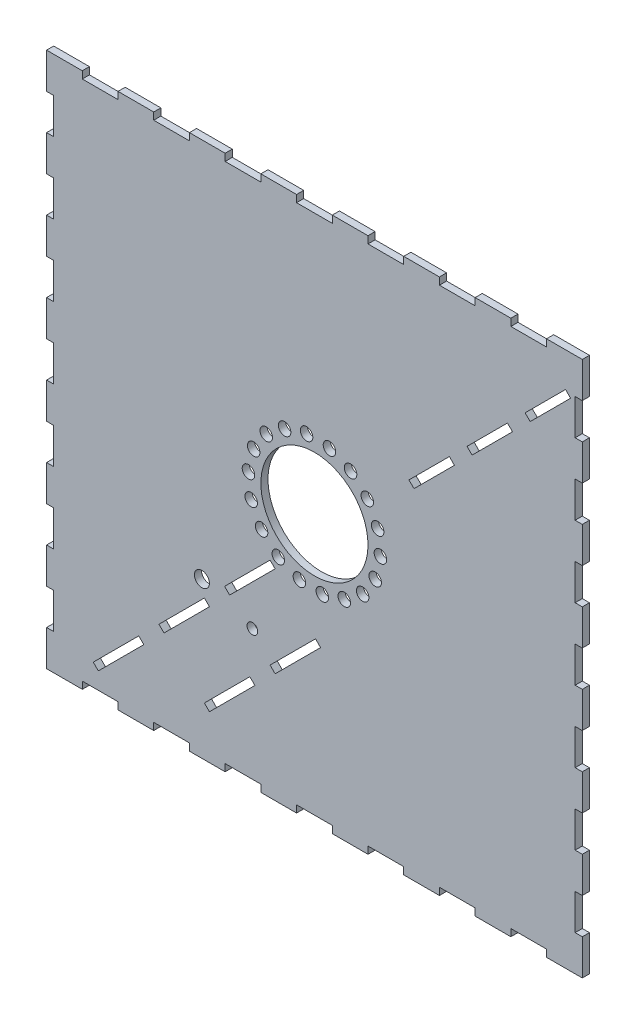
SolidWorks part; units mm, degrees
ref_plane "Front Plane" through (0, 0, 0) normal (0, 0, 1) x (1, 0, 0)
ref_plane "Top Plane" through (0, 0, 0) normal (0, 1, 0) x (1, 0, 0)
ref_plane "Right Plane" through (0, 0, 0) normal (1, 0, 0) x (0, 0, -1)
sketch "Sketch1" plane through (0, 0, 0) normal (0, 0, 1) x (1, 0, 0)
  line L1 (75, -75) -> (-75, -75)
  line L2 (75, -75) -> (75, 75)
  line L3 (75, 75) -> (-75, 75)
  line L4 (-75, -75) -> (-75, 75)
extrude "Boss-Extrude1" add sketch "Sketch1" against normal blind 2
other "Cavity1"
other "sideTop<2>@body1"
other "sideTop<1>@body1"
other "sideTop<3>@body1"
other "sideTop<4>@body1"
sketch "Sketch2" plane through (0, 0, 0) normal (0, 0, 1) x (1, 0, 0)
  line L116 (-75, -75) -> (-65, -75)
  line L117 (-65, -75) -> (-65, -73)
  line L118 (-65, -75) -> (-65, -73)
  line L119 (-65, -73) -> (-55, -73)
  line L120 (-65, -73) -> (-55, -73)
  line L121 (-55, -73) -> (-55, -75)
  line L122 (-55, -73) -> (-55, -75)
  line L123 (-55, -75) -> (-45, -75)
  line L124 (-55, -75) -> (-45, -75)
  line L125 (-45, -75) -> (-45, -73)
  line L126 (-45, -75) -> (-45, -73)
  line L127 (-45, -73) -> (-35, -73)
  line L128 (-45, -73) -> (-35, -73)
  line L129 (-35, -73) -> (-35, -75)
  line L130 (-35, -73) -> (-35, -75)
  line L131 (-35, -75) -> (-25, -75)
  line L132 (-35, -75) -> (-25, -75)
  line L133 (-25, -75) -> (-25, -73)
  line L134 (-25, -75) -> (-25, -73)
  line L135 (-25, -73) -> (-15, -73)
  line L136 (-25, -73) -> (-15, -73)
  line L137 (-15, -73) -> (-15, -75)
  line L138 (-15, -73) -> (-15, -75)
  line L139 (-15, -75) -> (-5, -75)
  line L140 (-15, -75) -> (-5, -75)
  line L141 (-5, -75) -> (-5, -73)
  line L142 (-5, -75) -> (-5, -73)
  line L143 (-5, -73) -> (5, -73)
  line L144 (-5, -73) -> (5, -73)
  line L145 (75, -75) -> (75, -65)
  line L146 (5, -73) -> (5, -75)
  line L147 (5, -73) -> (5, -75)
  line L148 (5, -75) -> (15, -75)
  line L149 (5, -75) -> (15, -75)
  line L150 (15, -75) -> (15, -73)
  line L151 (15, -75) -> (15, -73)
  line L152 (15, -73) -> (25, -73)
  line L153 (15, -73) -> (25, -73)
  line L154 (25, -73) -> (25, -75)
  line L155 (25, -73) -> (25, -75)
  line L156 (25, -75) -> (35, -75)
  line L157 (25, -75) -> (35, -75)
  line L158 (35, -75) -> (35, -73)
  line L159 (35, -75) -> (35, -73)
  line L160 (35, -73) -> (45, -73)
  line L161 (35, -73) -> (45, -73)
  line L162 (45, -73) -> (45, -75)
  line L163 (45, -73) -> (45, -75)
  line L164 (45, -75) -> (55, -75)
  line L165 (45, -75) -> (55, -75)
  line L166 (55, -75) -> (55, -73)
  line L167 (55, -75) -> (55, -73)
  line L168 (55, -73) -> (65, -73)
  line L169 (55, -73) -> (65, -73)
  line L170 (65, -73) -> (65, -75)
  line L171 (65, -73) -> (65, -75)
  line L172 (65, -75) -> (75, -75)
  line L173 (65, -75) -> (75, -75)
  line L174 (75, 75) -> (65, 75)
  line L175 (75, -65) -> (73, -65)
  line L176 (75, -65) -> (73, -65)
  line L177 (73, -65) -> (73, -55)
  line L178 (73, -65) -> (73, -55)
  line L179 (73, -55) -> (75, -55)
  line L180 (73, -55) -> (75, -55)
  line L181 (75, -55) -> (75, -45)
  line L182 (75, -55) -> (75, -45)
  line L183 (75, -45) -> (73, -45)
  line L184 (75, -45) -> (73, -45)
  line L185 (73, -45) -> (73, -35)
  line L186 (73, -45) -> (73, -35)
  line L187 (73, -35) -> (75, -35)
  line L188 (73, -35) -> (75, -35)
  line L189 (75, -35) -> (75, -25)
  line L190 (75, -35) -> (75, -25)
  line L191 (75, -25) -> (73, -25)
  line L192 (75, -25) -> (73, -25)
  line L193 (73, -25) -> (73, -15)
  line L194 (73, -25) -> (73, -15)
  line L195 (73, -15) -> (75, -15)
  line L196 (73, -15) -> (75, -15)
  line L197 (75, -15) -> (75, -5)
  line L198 (75, -15) -> (75, -5)
  line L199 (75, -5) -> (73, -5)
  line L200 (75, -5) -> (73, -5)
  line L201 (73, -5) -> (73, 5)
  line L202 (73, -5) -> (73, 5)
  line L203 (-75, 75) -> (-75, 65)
  line L204 (73, 5) -> (75, 5)
  line L205 (73, 5) -> (75, 5)
  line L206 (75, 5) -> (75, 15)
  line L207 (75, 5) -> (75, 15)
  line L208 (75, 15) -> (73, 15)
  line L209 (75, 15) -> (73, 15)
  line L210 (73, 15) -> (73, 25)
  line L211 (73, 15) -> (73, 25)
  line L212 (73, 25) -> (75, 25)
  line L213 (73, 25) -> (75, 25)
  line L214 (75, 25) -> (75, 35)
  line L215 (75, 25) -> (75, 35)
  line L216 (75, 35) -> (73, 35)
  line L217 (75, 35) -> (73, 35)
  line L218 (73, 35) -> (73, 45)
  line L219 (73, 35) -> (73, 45)
  line L220 (73, 45) -> (75, 45)
  line L221 (73, 45) -> (75, 45)
  line L222 (75, 45) -> (75, 55)
  line L223 (75, 45) -> (75, 55)
  line L224 (75, 55) -> (73, 55)
  line L225 (75, 55) -> (73, 55)
  line L226 (73, 55) -> (73, 65)
  line L227 (73, 55) -> (73, 65)
  line L228 (73, 65) -> (75, 65)
  line L229 (73, 65) -> (75, 65)
  line L230 (75, 65) -> (75, 75)
  line L231 (75, 65) -> (75, 75)
  line L232 (-75, -75) -> (-65, -75)
  line L261 (75, -75) -> (75, -65)
  line L290 (75, 75) -> (65, 75)
  line L319 (-75, 75) -> (-75, 65)
  line L348 (65, 75) -> (65, 73)
  line L349 (65, 75) -> (65, 73)
  line L350 (65, 73) -> (55, 73)
  line L351 (65, 73) -> (55, 73)
  line L352 (55, 73) -> (55, 75)
  line L353 (55, 73) -> (55, 75)
  line L354 (55, 75) -> (45, 75)
  line L355 (55, 75) -> (45, 75)
  line L356 (45, 75) -> (45, 73)
  line L357 (45, 75) -> (45, 73)
  line L358 (45, 73) -> (35, 73)
  line L359 (45, 73) -> (35, 73)
  line L360 (35, 73) -> (35, 75)
  line L361 (35, 73) -> (35, 75)
  line L362 (35, 75) -> (25, 75)
  line L363 (35, 75) -> (25, 75)
  line L364 (25, 75) -> (25, 73)
  line L365 (25, 75) -> (25, 73)
  line L366 (25, 73) -> (15, 73)
  line L367 (25, 73) -> (15, 73)
  line L368 (15, 73) -> (15, 75)
  line L369 (15, 73) -> (15, 75)
  line L370 (15, 75) -> (5, 75)
  line L371 (15, 75) -> (5, 75)
  line L372 (5, 75) -> (5, 73)
  line L373 (5, 75) -> (5, 73)
  line L374 (5, 73) -> (-5, 73)
  line L375 (5, 73) -> (-5, 73)
  line L376 (-5, 73) -> (-5, 75)
  line L377 (-5, 73) -> (-5, 75)
  line L378 (-5, 75) -> (-15, 75)
  line L379 (-5, 75) -> (-15, 75)
  line L380 (-15, 75) -> (-15, 73)
  line L381 (-15, 75) -> (-15, 73)
  line L382 (-15, 73) -> (-25, 73)
  line L383 (-15, 73) -> (-25, 73)
  line L384 (-25, 73) -> (-25, 75)
  line L385 (-25, 73) -> (-25, 75)
  line L386 (-25, 75) -> (-35, 75)
  line L387 (-25, 75) -> (-35, 75)
  line L388 (-35, 75) -> (-35, 73)
  line L389 (-35, 75) -> (-35, 73)
  line L390 (-35, 73) -> (-45, 73)
  line L391 (-35, 73) -> (-45, 73)
  line L392 (-45, 73) -> (-45, 75)
  line L393 (-45, 73) -> (-45, 75)
  line L394 (-45, 75) -> (-55, 75)
  line L395 (-45, 75) -> (-55, 75)
  line L396 (-55, 75) -> (-55, 73)
  line L397 (-55, 75) -> (-55, 73)
  line L398 (-55, 73) -> (-65, 73)
  line L399 (-55, 73) -> (-65, 73)
  line L400 (-65, 73) -> (-65, 75)
  line L401 (-65, 73) -> (-65, 75)
  line L402 (-65, 75) -> (-75, 75)
  line L403 (-65, 75) -> (-75, 75)
  line L404 (-75, 65) -> (-73, 65)
  line L405 (-75, 65) -> (-73, 65)
  line L406 (-73, 65) -> (-73, 55)
  line L407 (-73, 65) -> (-73, 55)
  line L408 (-73, 55) -> (-75, 55)
  line L409 (-73, 55) -> (-75, 55)
  line L410 (-75, 55) -> (-75, 45)
  line L411 (-75, 55) -> (-75, 45)
  line L412 (-75, 45) -> (-73, 45)
  line L413 (-75, 45) -> (-73, 45)
  line L414 (-73, 45) -> (-73, 35)
  line L415 (-73, 45) -> (-73, 35)
  line L416 (-73, 35) -> (-75, 35)
  line L417 (-73, 35) -> (-75, 35)
  line L418 (-75, 35) -> (-75, 25)
  line L419 (-75, 35) -> (-75, 25)
  line L420 (-75, 25) -> (-73, 25)
  line L421 (-75, 25) -> (-73, 25)
  line L422 (-73, 25) -> (-73, 15)
  line L423 (-73, 25) -> (-73, 15)
  line L424 (-73, 15) -> (-75, 15)
  line L425 (-73, 15) -> (-75, 15)
  line L426 (-75, 15) -> (-75, 5)
  line L427 (-75, 15) -> (-75, 5)
  line L428 (-75, 5) -> (-73, 5)
  line L429 (-75, 5) -> (-73, 5)
  line L430 (-73, 5) -> (-73, -5)
  line L431 (-73, 5) -> (-73, -5)
  line L432 (-73, -5) -> (-75, -5)
  line L433 (-73, -5) -> (-75, -5)
  line L434 (-75, -5) -> (-75, -15)
  line L435 (-75, -5) -> (-75, -15)
  line L436 (-75, -15) -> (-73, -15)
  line L437 (-75, -15) -> (-73, -15)
  line L438 (-73, -15) -> (-73, -25)
  line L439 (-73, -15) -> (-73, -25)
  line L440 (-73, -25) -> (-75, -25)
  line L441 (-73, -25) -> (-75, -25)
  line L442 (-75, -25) -> (-75, -35)
  line L443 (-75, -25) -> (-75, -35)
  line L444 (-75, -35) -> (-73, -35)
  line L445 (-75, -35) -> (-73, -35)
  line L446 (-73, -35) -> (-73, -45)
  line L447 (-73, -35) -> (-73, -45)
  line L448 (-73, -45) -> (-75, -45)
  line L449 (-73, -45) -> (-75, -45)
  line L450 (-75, -45) -> (-75, -55)
  line L451 (-75, -45) -> (-75, -55)
  line L452 (-75, -55) -> (-73, -55)
  line L453 (-75, -55) -> (-73, -55)
  line L454 (-73, -55) -> (-73, -65)
  line L455 (-73, -55) -> (-73, -65)
  line L456 (-73, -65) -> (-75, -65)
  line L457 (-73, -65) -> (-75, -65)
  line L458 (-75, -65) -> (-75, -75)
  line L459 (-75, -65) -> (-75, -75)
  circle A0 centre (0, 0) radius 15 construction
  circle A1 centre (0, 0) radius 15
  dimension "D1" = 0
extrude "Cut-Extrude2" cut sketch "Sketch2" against normal blind 2 contours A1
sketch "Sketch4" plane through (0, 0, 0) normal (0, 0, 1) x (1, 0, 0)
  circle A0 centre (10.1185, 15.4876) radius 1.75 construction
  circle A1 centre (10.1185, 15.4876) radius 1.75
  circle A2 centre (17.7065, 5.3602) radius 1.75 construction
  circle A3 centre (14.8053, 11.0929) radius 1.75 construction
  circle A4 centre (-2.2041, 18.3682) radius 1.75 construction
  circle A5 centre (4.2112, 18.0143) radius 1.75 construction
  circle A6 centre (17.7065, 5.3602) radius 1.75
  circle A7 centre (14.8053, 11.0929) radius 1.75
  circle A8 centre (-2.2041, 18.3682) radius 1.75
  circle A9 centre (4.2112, 18.0143) radius 1.75
  circle A10 centre (-17.0094, 7.2753) radius 1.75 construction
  circle A11 centre (-13.4953, 12.6541) radius 1.75 construction
  circle A12 centre (-8.3534, 16.5067) radius 1.75 construction
  circle A13 centre (-17.0094, 7.2753) radius 1.75
  circle A14 centre (-13.4953, 12.6541) radius 1.75
  circle A15 centre (-8.3534, 16.5067) radius 1.75
  circle A16 centre (13.4953, -12.6541) radius 1.75 construction
  circle A17 centre (17.0094, -7.2753) radius 1.75 construction
  circle A18 centre (18.4719, -1.019) radius 1.75 construction
  circle A19 centre (13.4953, -12.6541) radius 1.75
  circle A20 centre (17.0094, -7.2753) radius 1.75
  circle A21 centre (18.4719, -1.019) radius 1.75
  circle A22 centre (-18.4719, 1.019) radius 1.75 construction
  circle A23 centre (-17.7065, -5.3602) radius 1.75 construction
  circle A24 centre (-14.8053, -11.0929) radius 1.75 construction
  circle A25 centre (-10.1185, -15.4876) radius 1.75 construction
  circle A26 centre (-4.2112, -18.0143) radius 1.75 construction
  circle A27 centre (2.2041, -18.3682) radius 1.75 construction
  circle A28 centre (8.3534, -16.5067) radius 1.75 construction
  circle A29 centre (-18.4719, 1.019) radius 1.75
  circle A30 centre (-17.7065, -5.3602) radius 1.75
  circle A31 centre (-14.8053, -11.0929) radius 1.75
  circle A32 centre (-10.1185, -15.4876) radius 1.75
  circle A33 centre (-4.2112, -18.0143) radius 1.75
  circle A34 centre (2.2041, -18.3682) radius 1.75
  circle A35 centre (8.3534, -16.5067) radius 1.75
extrude "Cut-Extrude3" cut sketch "Sketch4" against normal blind 2 contours A6 | A7 | A1 | A9 | A8 | A15 | A14 | A13 | A19 | A20 | A29 | A21 | A30 | A31 | A32 | A33 | A34 | A35
sketch "Sketch5" plane through (0, 0, -2) normal (0, 0, -1) x (-1, 0, 0)
  circle A2 centre (31.5129, -31.5129) radius 2.1
  dimension "D1" = 4.2
extrude "Cut-Extrude4" cut sketch "Sketch5" against normal blind 2
sketch "Sketch7" plane through (0, 0, -2) normal (0, 0, -1) x (-1, 0, 0)
  line L0 (60.5043, -65.4541) -> (49.1906, -54.1403) construction
  line L1 (47.7764, -55.5546) -> (59.0901, -66.8683) construction
  line L2 (16.6637, -49.8977) -> (27.9774, -61.2114)
  line L3 (18.0779, -48.4835) -> (29.3916, -59.7972)
  line L4 (27.9774, -61.2114) -> (29.3916, -62.6256)
  line L5 (29.3916, -62.6256) -> (30.8058, -61.2114)
  line L6 (60.5043, -65.4541) -> (49.1906, -54.1403)
  line L7 (47.7764, -55.5546) -> (59.0901, -66.8683)
  line L12 (30.8058, -61.2114) -> (29.3916, -59.7972)
  line L15 (42.1195, -47.0693) -> (30.8058, -35.7556) construction
  line L16 (29.3916, -37.1698) -> (40.7053, -48.4835) construction
  line L21 (42.1195, -47.0693) -> (30.8058, -35.7556)
  line L22 (29.3916, -37.1698) -> (40.7053, -48.4835)
  line L24 (29.3916, -37.1698) -> (30.8058, -35.7556)
  line L25 (40.7053, -48.4835) -> (42.1195, -49.8977)
  line L26 (42.1195, -49.8977) -> (43.5337, -48.4835)
  line L27 (23.7348, -28.6845) -> (12.421, -17.3708) construction
  line L28 (11.0068, -18.785) -> (22.3205, -30.0987) construction
  line L29 (43.5337, -48.4835) -> (42.1195, -47.0693)
  line L33 (23.7348, -28.6845) -> (12.421, -17.3708)
  line L34 (11.0068, -18.785) -> (22.3205, -30.0987)
  line L36 (49.1906, -54.1403) -> (47.7764, -55.5546)
  line L37 (60.5043, -65.4541) -> (61.9185, -66.8683)
  line L38 (61.9185, -66.8683) -> (60.5043, -68.2825)
  line L39 (60.5043, -68.2825) -> (59.0901, -66.8683)
  line L55 (11.0068, -41.4124) -> (-0.3069, -30.0987) construction
  line L56 (-1.7211, -31.5129) -> (9.5926, -42.8266) construction
  line L61 (11.0068, -41.4124) -> (-0.3069, -30.0987)
  line L62 (-1.7211, -31.5129) -> (9.5926, -42.8266)
  line L64 (22.3205, -30.0987) -> (23.7348, -31.5129)
  line L65 (23.7348, -31.5129) -> (25.149, -30.0987)
  line L66 (25.149, -30.0987) -> (23.7348, -28.6845)
  line L67 (11.0068, -18.785) -> (12.421, -17.3708)
  line L68 (-1.7211, -31.5129) -> (-0.3069, -30.0987)
  line L69 (16.6637, -49.8977) -> (18.0779, -48.4835)
  line L70 (11.0068, -41.4124) -> (12.421, -42.8266)
  line L71 (12.421, -42.8266) -> (11.0068, -44.2409)
  line L72 (11.0068, -44.2409) -> (9.5926, -42.8266)
  point P5 (17.3708, -49.1906)
extrude "Cut-Extrude5" cut sketch "Sketch7" against normal blind 2
other "Cavity2"
other "tail<1>@body1"
sketch "Sketch8" plane through (0, 0, 0) normal (0, 0, 1) x (1, 0, 0)
  spline S0 degree 3 poles (-1036.5149, 296.2974) (-747.571, 550.6452) (-206.6447, 51.7455) (-583.7601, -388.0215) (-430.6338, -1226.0945) (780.8246, -977.0959) (396.0676, -381.2071) knots 0 0 0 0 0.296959 0.382666 0.556914 1 1 1 1
sketch "Sketch9" plane through (0, 0, 0) normal (0, 0, 1) x (1, 0, 0)
  circle A0 centre (-17.3708, -36.4627) radius 1.5 construction
  circle A1 centre (-17.3708, -36.4627) radius 1.5
extrude "Cut-Extrude6" cut sketch "Sketch9" against normal blind 2
equation "\"anch\" = 2"
equation "\"alt\" = 100"
equation "\"pilanch\" = 100"
equation "\"pilalt\" = 250"
equation "\"bodyHeigh\" = 60"
equation "\"dorsalFinHeigh\" = 400"
equation "\"D1@Boss-Extrude1\"=\"anch\""
equation "\"D1@Cut-Extrude2\"=\"anch\""
equation "\"D1@Cut-Extrude3\"=\"anch\""
equation "\"D1@Cut-Extrude4\"=\"anch\""
equation "\"D1@Cut-Extrude5\"=\"anch\""
equation "\"D1@Sketch7\"=\"anch\""
equation "\"D2@Sketch7\"=\"anch\""
equation "\"D3@Sketch7\"=\"anch\""
equation "\"D5@Sketch7\"=\"anch\""
equation "\"D1@Cut-Extrude6\"=\"anch\""
